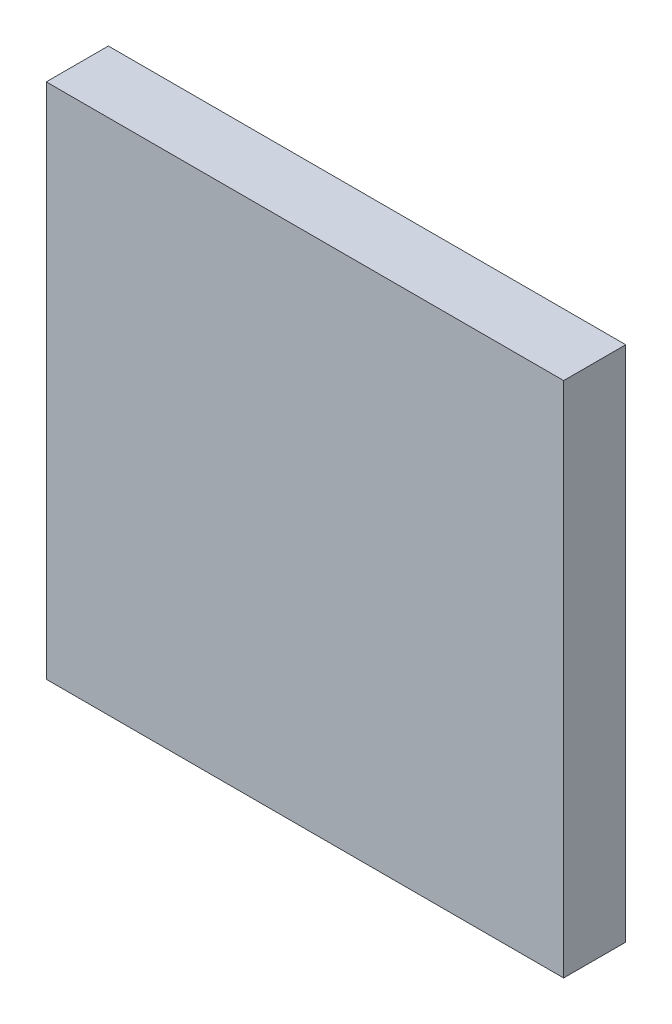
SolidWorks part; units mm, degrees
ref_plane "Front Plane" through (0, 0, 0) normal (0, 0, 1) x (1, 0, 0)
ref_plane "Top Plane" through (0, 0, 0) normal (0, 1, 0) x (1, 0, 0)
ref_plane "Right Plane" through (0, 0, 0) normal (1, 0, 0) x (0, 0, -1)
sketch "Sketch1" plane through (0, 0, 0) normal (0, 0, 1) x (1, 0, 0)
  line L1 (0, 0) -> (10, 0)
  line L2 (0, 0) -> (0, 10)
  line L3 (0, 10) -> (10, 10)
  line L4 (10, 0) -> (10, 10)
  dimension "D1" = 10
extrude "Boss-Extrude1" add sketch "Sketch1" along normal blind 1.2
